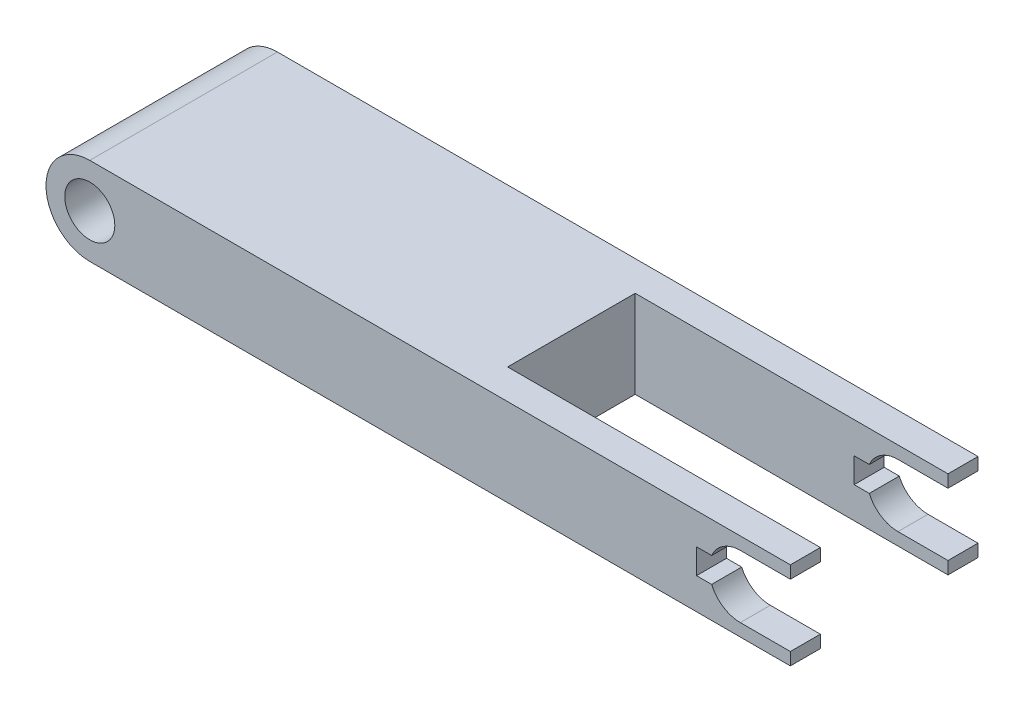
SolidWorks part; units mm, degrees
ref_plane "前视基准面" through (0, 0, 0) normal (0, 0, 1) x (1, 0, 0)
ref_plane "上视基准面" through (0, 0, 0) normal (0, 1, 0) x (1, 0, 0)
ref_plane "右视基准面" through (0, 0, 0) normal (1, 0, 0) x (0, 0, -1)
sketch "草图1" plane through (0, 0, 0) normal (0, 0, 1) x (1, 0, 0)
  line L1 (26, 3.5) -> (-26, 3.5)
  line L2 (26, 3.5) -> (26, -3.5)
  line L3 (26, -3.5) -> (-26, -3.5)
  line L4 (-26, 3.5) -> (-26, -3.5)
  line L5 (26, 3.5) -> (-26, -3.5) construction
  line L6 (26, -3.5) -> (-26, 3.5) construction
  point P0 (0, 0)
  dimension "D1" = 7
  dimension "D2" = 52
extrude "凸台-拉伸1" add sketch "草图1" along normal mid plane 15
sketch "草图3" plane through (0, 0, 0) normal (0, 0, 1) x (1, 0, 0)
  line L0 (26, 0) -> (5, 0) construction
  line L1 (26, -3.5) -> (26, 3.5) construction
  line L2 (26, -3.5) -> (5, -3.5)
  line L3 (26, 3.5) -> (5, 3.5)
  line L4 (5, 3.5) -> (5, -3.5)
  arc A0 (26, -3.5) -> (26, 3.5) centre (26, 0) ccw
  arc A1 (5, 3.5) -> (5, -3.5) centre (5, 0) ccw
  point P5 (15.5, 0)
  dimension "D1" = 3.5
  dimension "D2" = 21
extrude "切除-拉伸1" cut sketch "草图3" against normal mid plane 10.2
sketch "草图7" plane through (0, 0, 7.5) normal (0, 0, 1) x (1, 0, 0)
  line L0 (-26, 3.5) -> (-26, -3.5) construction
  circle A0 centre (-26, 0) radius 3.5
extrude "凸台-拉伸4" add sketch "草图7" against normal blind 15
sketch "草图9" plane through (0, 0, 7.5) normal (0, 0, 1) x (1, 0, 0)
  line L0 (26, -3.5) -> (26, 3.5) construction
  circle A0 centre (26, 0) radius 2.5
  dimension "D1" = 5
extrude "切除-拉伸3" cut sketch "草图9" against normal through all
sketch "草图11" plane through (0, 0, 7.5) normal (0, 0, 1) x (1, 0, 0)
  line L1 (24.5, 1) -> (22.5, 1)
  line L2 (24.5, 1) -> (24.5, -1)
  line L3 (24.5, -1) -> (22.5, -1)
  line L4 (22.5, 1) -> (22.5, -1)
  line L5 (24.5, 1) -> (22.5, -1) construction
  line L6 (24.5, -1) -> (22.5, 1) construction
  arc A0 (26, 2.5) -> (26, -2.5) centre (26, 0) ccw construction
  point P0 (23.5, 0)
  dimension "D1" = 2
  dimension "D2" = 2
extrude "切除-拉伸5" cut sketch "草图11" against normal through all
sketch "草图12" plane through (26, 0, 0) normal (1, 0, 0) x (0, 0, -1)
  line L4 (-7.5, 3.5) -> (-7.5, 2.5)
  line L5 (-7.5, 2.5) -> (-5.1, 2.5)
  line L6 (-5.1, 2.5) -> (-5.1, 3.5)
  line L7 (-5.1, 3.5) -> (-7.5, 3.5)
  line L8 (-7.5, 3.5) -> (-7.5, 2.5)
  line L9 (-7.5, 2.5) -> (-5.1, 2.5)
  line L10 (-5.1, 2.5) -> (-5.1, 3.5)
  line L11 (-5.1, 3.5) -> (-7.5, 3.5)
  line L12 (-5.1, -3.5) -> (-5.1, -2.5)
  line L13 (-5.1, -2.5) -> (-7.5, -2.5)
  line L14 (-7.5, -2.5) -> (-7.5, -3.5)
  line L15 (-7.5, -3.5) -> (-5.1, -3.5)
  line L16 (-5.1, -3.5) -> (-5.1, -2.5)
  line L17 (-5.1, -2.5) -> (-7.5, -2.5)
  line L18 (-7.5, -2.5) -> (-7.5, -3.5)
  line L19 (-7.5, -3.5) -> (-5.1, -3.5)
  line L20 (7.5, -3.5) -> (7.5, -2.5)
  line L21 (7.5, -2.5) -> (5.1, -2.5)
  line L22 (5.1, -2.5) -> (5.1, -3.5)
  line L23 (5.1, -3.5) -> (7.5, -3.5)
  line L24 (7.5, -3.5) -> (7.5, -2.5)
  line L25 (7.5, -2.5) -> (5.1, -2.5)
  line L26 (5.1, -2.5) -> (5.1, -3.5)
  line L27 (5.1, -3.5) -> (7.5, -3.5)
  line L28 (5.1, 3.5) -> (5.1, 2.5)
  line L29 (5.1, 2.5) -> (7.5, 2.5)
  line L30 (7.5, 2.5) -> (7.5, 3.5)
  line L31 (7.5, 3.5) -> (5.1, 3.5)
  line L32 (5.1, 3.5) -> (5.1, 2.5)
  line L33 (5.1, 2.5) -> (7.5, 2.5)
  line L34 (7.5, 2.5) -> (7.5, 3.5)
  line L35 (7.5, 3.5) -> (5.1, 3.5)
  dimension "D1" = 0
  dimension "D2" = 0
  dimension "D3" = 0
  dimension "D4" = 0
extrude "凸台-拉伸5" add sketch "草图12" along normal blind 4
sketch "草图13" plane through (0, 0, 7.5) normal (0, 0, 1) x (1, 0, 0)
  circle A0 centre (-26, 0) radius 2
  dimension "D1" = 4
extrude "切除-拉伸6" cut sketch "草图13" against normal through all
